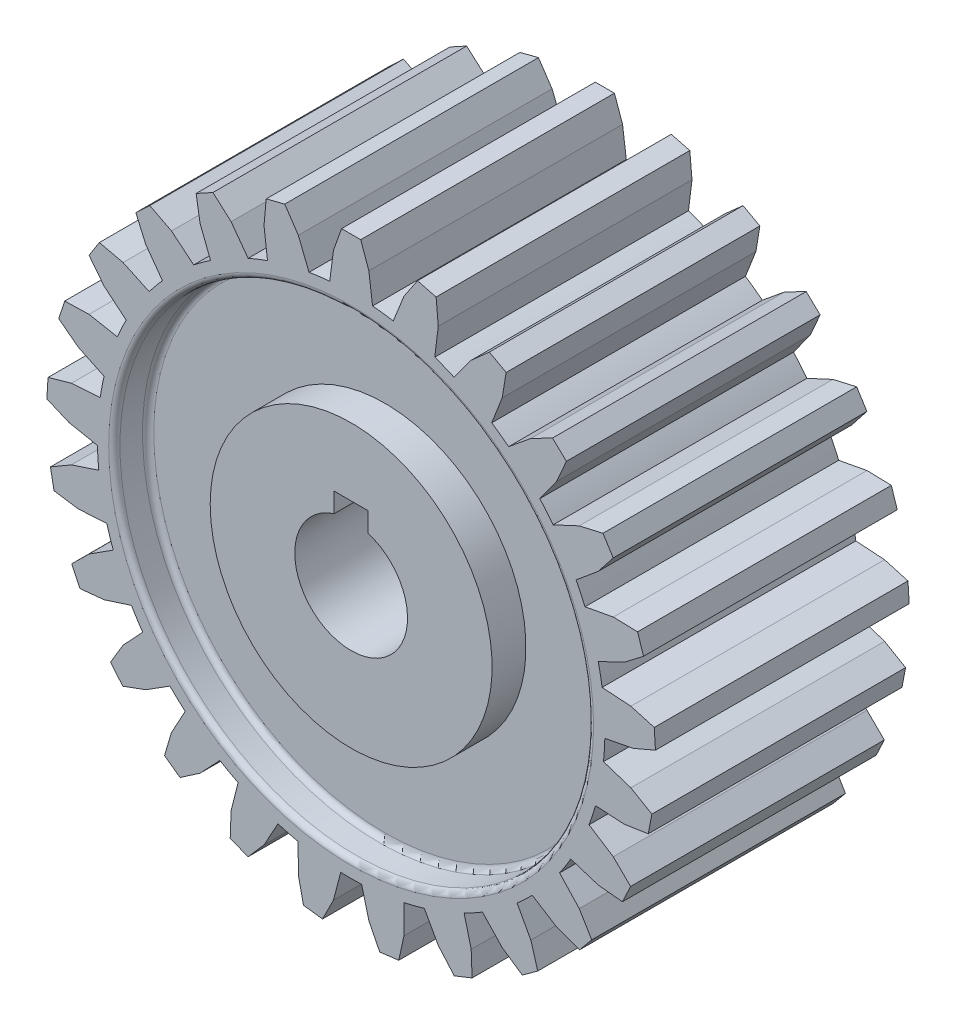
SolidWorks part; units mm, degrees
ref_plane "Front Plane" through (0, 0, 0) normal (0, 0, 1) x (1, 0, 0)
ref_plane "Top Plane" through (0, 0, 0) normal (0, 1, 0) x (1, 0, 0)
ref_plane "Right Plane" through (0, 0, 0) normal (1, 0, 0) x (0, 0, -1)
sketch "Sketch1" plane through (0, 0, 0) normal (0, 0, 1) x (1, 0, 0)
  line L0 (0, 0) -> (0, 96.9326) construction
  line L1 (-4.826, 56.9459) -> (-3.9897, 63.3745)
  line L2 (-3.9897, 63.3745) -> (-2.159, 68.546)
  line L3 (4.826, 56.9459) -> (3.9897, 63.3745)
  line L4 (3.9897, 63.3745) -> (2.159, 68.546)
  line L5 (-2.159, 68.546) -> (2.159, 68.546)
  line L6 (14.9555, 66.9294) -> (19.1379, 65.8556)
  line L7 (11.8962, 62.3757) -> (14.9555, 66.9294)
  line L8 (9.4875, 56.357) -> (11.8962, 62.3757)
  line L9 (18.8362, 53.9566) -> (19.625, 60.3913)
  line L10 (19.625, 60.3913) -> (19.1379, 65.8556)
  line L11 (31.1303, 61.1074) -> (34.9142, 59.0272)
  line L12 (27.0347, 57.4576) -> (31.1303, 61.1074)
  line L13 (23.2048, 52.227) -> (27.0347, 57.4576)
  line L14 (31.6629, 47.5771) -> (34.0271, 53.6135)
  line L15 (34.0271, 53.6135) -> (34.9142, 59.0272)
  line L16 (45.3491, 51.4458) -> (48.4968, 48.49)
  line L17 (40.4745, 48.9292) -> (45.3491, 51.4458)
  line L18 (35.4641, 44.8154) -> (40.4745, 48.9292)
  line L19 (42.5001, 38.2081) -> (46.2912, 43.4669)
  line L20 (46.2912, 43.4669) -> (48.4968, 48.49)
  line L21 (56.7185, 38.5517) -> (59.0322, 34.9059)
  line L22 (51.3711, 37.3264) -> (56.7185, 38.5517)
  line L23 (45.4951, 34.5879) -> (51.3711, 37.3264)
  line L24 (50.6669, 26.4384) -> (55.6467, 30.5892)
  line L25 (55.6467, 30.5892) -> (59.0322, 34.9059)
  line L26 (64.524, 23.2352) -> (65.8583, 19.1286)
  line L27 (59.0399, 23.3782) -> (64.524, 23.2352)
  line L28 (52.6674, 22.187) -> (59.0399, 23.3782)
  line L29 (55.6501, 13.0074) -> (61.5057, 15.7894)
  line L30 (61.5057, 15.7894) -> (65.8583, 19.1286)
  line L31 (68.2752, 6.4588) -> (68.5463, 2.1493)
  line L32 (62.999, 7.9612) -> (68.2752, 6.4588)
  line L33 (56.5305, 8.3921) -> (62.999, 7.9612)
  line L34 (57.1365, -1.2408) -> (63.5, -0.0025)
  line L35 (63.5, -0.0025) -> (68.5463, 2.1493)
  line L36 (67.7364, -10.7235) -> (66.9273, -14.965)
  line L37 (62.9996, -7.9562) -> (67.7364, -10.7235)
  line L38 (56.8415, -5.9301) -> (62.9996, -7.9562)
  line L39 (55.0329, -15.4111) -> (61.5044, -15.7942)
  line L40 (61.5044, -15.7942) -> (66.9273, -14.965)
  line L41 (62.9415, -27.2319) -> (61.103, -31.139)
  line L42 (59.0417, -23.3736) -> (62.9415, -27.2319)
  line L43 (53.581, -19.8797) -> (59.0417, -23.3736)
  line L44 (49.4714, -28.6131) -> (55.6443, -30.5936)
  line L45 (55.6443, -30.5936) -> (61.103, -31.139)
  line L46 (54.1918, -42.0293) -> (51.4394, -45.3564)
  line L47 (51.3741, -37.3223) -> (54.1918, -42.0293)
  line L48 (46.9538, -32.5802) -> (51.3741, -37.3223)
  line L49 (40.8013, -40.0172) -> (46.2878, -43.4706)
  line L50 (46.2878, -43.4706) -> (51.4394, -45.3564)
  line L51 (42.037, -54.1859) -> (38.5437, -56.7239)
  line L52 (40.4784, -48.926) -> (42.037, -54.1859)
  line L53 (37.3763, -43.2335) -> (40.4784, -48.926)
  line L54 (29.5676, -48.9068) -> (34.0229, -53.6162)
  line L55 (34.0229, -53.6162) -> (38.5437, -56.7239)
  line L56 (27.2409, -62.9377) -> (23.2261, -64.5272)
  line L57 (27.0393, -57.4554) -> (27.2409, -62.9377)
  line L58 (25.4503, -51.1704) -> (27.0393, -57.4554)
  line L59 (16.4761, -54.7235) -> (19.6202, -60.3929)
  line L60 (19.6202, -60.3929) -> (23.2261, -64.5272)
  line L61 (10.7331, -67.7349) -> (6.4491, -68.2761)
  line L62 (11.9012, -62.3748) -> (10.7331, -67.7349)
  line L63 (11.9252, -55.892) -> (11.9012, -62.3748)
  line L64 (2.3493, -57.1017) -> (3.9847, -63.3749)
  line L65 (3.9847, -63.3749) -> (6.4491, -68.2761)
  line L66 (-6.4491, -68.2761) -> (-10.7331, -67.7349)
  line L67 (-3.9847, -63.3749) -> (-6.4491, -68.2761)
  line L68 (-2.3493, -57.1017) -> (-3.9847, -63.3749)
  line L69 (-11.9252, -55.892) -> (-11.9012, -62.3748)
  line L70 (-11.9012, -62.3748) -> (-10.7331, -67.7349)
  line L71 (-23.2261, -64.5272) -> (-27.2409, -62.9377)
  line L72 (-19.6202, -60.3929) -> (-23.2261, -64.5272)
  line L73 (-16.4761, -54.7235) -> (-19.6202, -60.3929)
  line L74 (-25.4503, -51.1704) -> (-27.0393, -57.4554)
  line L75 (-27.0393, -57.4554) -> (-27.2409, -62.9377)
  line L76 (-38.5437, -56.7239) -> (-42.037, -54.1859)
  line L77 (-34.0229, -53.6162) -> (-38.5437, -56.7239)
  line L78 (-29.5676, -48.9068) -> (-34.0229, -53.6162)
  line L79 (-37.3763, -43.2335) -> (-40.4784, -48.926)
  line L80 (-40.4784, -48.926) -> (-42.037, -54.1859)
  line L81 (-51.4394, -45.3564) -> (-54.1918, -42.0293)
  line L82 (-46.2878, -43.4706) -> (-51.4394, -45.3564)
  line L83 (-40.8013, -40.0172) -> (-46.2878, -43.4706)
  line L84 (-46.9538, -32.5802) -> (-51.3741, -37.3223)
  line L85 (-51.3741, -37.3223) -> (-54.1918, -42.0293)
  line L86 (-61.103, -31.139) -> (-62.9415, -27.2319)
  line L87 (-55.6443, -30.5936) -> (-61.103, -31.139)
  line L88 (-49.4714, -28.6131) -> (-55.6443, -30.5936)
  line L89 (-53.581, -19.8797) -> (-59.0417, -23.3736)
  line L90 (-59.0417, -23.3736) -> (-62.9415, -27.2319)
  line L91 (-66.9273, -14.965) -> (-67.7364, -10.7235)
  line L92 (-61.5044, -15.7942) -> (-66.9273, -14.965)
  line L93 (-55.0329, -15.4111) -> (-61.5044, -15.7942)
  line L94 (-56.8415, -5.9301) -> (-62.9996, -7.9562)
  line L95 (-62.9996, -7.9562) -> (-67.7364, -10.7235)
  line L96 (-68.5463, 2.1493) -> (-68.2752, 6.4588)
  line L97 (-63.5, -0.0025) -> (-68.5463, 2.1493)
  line L98 (-57.1365, -1.2408) -> (-63.5, -0.0025)
  line L99 (-56.5305, 8.3921) -> (-62.999, 7.9612)
  line L100 (-62.999, 7.9612) -> (-68.2752, 6.4588)
  line L101 (-65.8583, 19.1286) -> (-64.524, 23.2352)
  line L102 (-61.5057, 15.7894) -> (-65.8583, 19.1286)
  line L103 (-55.6501, 13.0074) -> (-61.5057, 15.7894)
  line L104 (-52.6674, 22.187) -> (-59.0399, 23.3782)
  line L105 (-59.0399, 23.3782) -> (-64.524, 23.2352)
  line L106 (-59.0322, 34.9059) -> (-56.7185, 38.5517)
  line L107 (-55.6467, 30.5892) -> (-59.0322, 34.9059)
  line L108 (-50.6669, 26.4384) -> (-55.6467, 30.5892)
  line L109 (-45.4951, 34.5879) -> (-51.3711, 37.3264)
  line L110 (-51.3711, 37.3264) -> (-56.7185, 38.5517)
  line L111 (-48.4968, 48.49) -> (-45.3491, 51.4458)
  line L112 (-46.2912, 43.4669) -> (-48.4968, 48.49)
  line L113 (-42.5001, 38.2081) -> (-46.2912, 43.4669)
  line L114 (-35.4641, 44.8154) -> (-40.4745, 48.9292)
  line L115 (-40.4745, 48.9292) -> (-45.3491, 51.4458)
  line L116 (-34.9142, 59.0272) -> (-31.1303, 61.1074)
  line L117 (-34.0271, 53.6135) -> (-34.9142, 59.0272)
  line L118 (-31.6629, 47.5771) -> (-34.0271, 53.6135)
  line L119 (-23.2048, 52.227) -> (-27.0347, 57.4576)
  line L120 (-27.0347, 57.4576) -> (-31.1303, 61.1074)
  line L121 (-19.1379, 65.8556) -> (-14.9555, 66.9294)
  line L122 (-19.625, 60.3913) -> (-19.1379, 65.8556)
  line L123 (-18.8362, 53.9566) -> (-19.625, 60.3913)
  line L124 (-9.4875, 56.357) -> (-11.8962, 62.3757)
  line L125 (-11.8962, 62.3757) -> (-14.9555, 66.9294)
  circle A0 centre (0, 0) radius 63.5 construction
  circle A1 centre (0, 0) radius 68.58 construction
  arc A2 (-31.6629, 47.5771) -> (-35.4641, 44.8154) centre (0, 0) ccw
  arc A3 (-42.5001, 38.2081) -> (-45.4951, 34.5879) centre (0, 0) ccw
  arc A4 (-18.8362, 53.9566) -> (-23.2048, 52.227) centre (0, 0) ccw
  arc A5 (-4.826, 56.9459) -> (-9.4875, 56.357) centre (0, 0) ccw
  arc A6 (9.4875, 56.357) -> (4.826, 56.9459) centre (0, 0) ccw
  arc A7 (23.2048, 52.227) -> (18.8362, 53.9566) centre (0, 0) ccw
  arc A8 (35.4641, 44.8154) -> (31.6629, 47.5771) centre (0, 0) ccw
  arc A9 (45.4951, 34.5879) -> (42.5001, 38.2081) centre (0, 0) ccw
  arc A10 (52.6674, 22.187) -> (50.6669, 26.4384) centre (0, 0) ccw
  arc A11 (56.5305, 8.3921) -> (55.6501, 13.0074) centre (0, 0) ccw
  arc A12 (56.8415, -5.9301) -> (57.1365, -1.2408) centre (0, 0) ccw
  arc A13 (53.581, -19.8797) -> (55.0329, -15.4111) centre (0, 0) ccw
  arc A14 (46.9538, -32.5802) -> (49.4714, -28.6131) centre (0, 0) ccw
  arc A15 (37.3763, -43.2335) -> (40.8013, -40.0172) centre (0, 0) ccw
  arc A16 (25.4503, -51.1704) -> (29.5676, -48.9068) centre (0, 0) ccw
  arc A17 (11.9252, -55.892) -> (16.4761, -54.7235) centre (0, 0) ccw
  arc A18 (-2.3493, -57.1017) -> (2.3493, -57.1017) centre (0, 0) ccw
  arc A19 (-16.4761, -54.7235) -> (-11.9252, -55.892) centre (0, 0) ccw
  arc A20 (-29.5676, -48.9068) -> (-25.4503, -51.1704) centre (0, 0) ccw
  arc A21 (-40.8013, -40.0172) -> (-37.3763, -43.2335) centre (0, 0) ccw
  arc A22 (-49.4714, -28.6131) -> (-46.9538, -32.5802) centre (0, 0) ccw
  arc A23 (-55.0329, -15.4111) -> (-53.581, -19.8797) centre (0, 0) ccw
  arc A24 (-57.1365, -1.2408) -> (-56.8415, -5.9301) centre (0, 0) ccw
  arc A25 (-50.6669, 26.4384) -> (-52.6674, 22.187) centre (0, 0) ccw
  arc A26 (-55.6501, 13.0074) -> (-56.5305, 8.3921) centre (0, 0) ccw
  point P159 (0, 0)
  dimension "D1" = 127
  dimension "D2" = 137.16
  dimension "D3" = 114.3
  dimension "D4" = 9.652
  dimension "D5" = 7.9794
  dimension "D6" = 4.318
  dimension "D7" = 25
extrude "Boss-Extrude2" add sketch "Sketch1" along normal blind 57.15
sketch "Sketch5" plane through (0, 0, 57.15) normal (0, 0, 1) x (1, 0, 0)
  circle A0 centre (0, 0) radius 53.34
  dimension "D1" = 106.68
extrude "Cut-Extrude3" cut sketch "Sketch5" against normal blind 7.62
sketch "Sketch6" plane through (0, 0, 49.53) normal (0, 0, 1) x (1, 0, 0)
  circle A0 centre (0, 0) radius 31.75
  dimension "D1" = 63.5
extrude "Boss-Extrude4" add sketch "Sketch6" along normal blind 7.62
sketch "Sketch7" plane through (0, 0, 57.15) normal (0, 0, 1) x (1, 0, 0)
  line L0 (0, 0) -> (0, 45.664) construction
  line L2 (3.81, 16.51) -> (-3.81, 16.51)
  line L3 (3.81, 16.51) -> (3.81, 12.115)
  line L5 (-3.81, 16.51) -> (-3.81, 12.115)
  line L6 (3.81, 16.51) -> (0, 12.7) construction
  line L7 (3.81, 8.89) -> (-3.81, 16.51) construction
  arc A0 (-3.81, 12.115) -> (3.81, 12.115) centre (0, 0) ccw
  point P3 (0, 12.7)
  dimension "D1" = 25.4
  dimension "D2" = 7.62
extrude "Cut-Extrude4" cut sketch "Sketch7" against normal blind 108.458
fillet "Fillet1" radius 1.27 1 edges at (53.34, 0, 49.53)
fillet "Fillet3" radius 1.27 1 edges at (53.34, 0, 57.15)
ref_plane "Plane1" through (0, 0, 28.575) normal (0, 0, 1) x (1, 0, 0)
mirror "Mirror3" about plane through (0, 0, 28.575) normal (0, 0, 1) of "Cut-Extrude4", "Cut-Extrude3", "Boss-Extrude4"
fillet "Fillet4" radius 1.27 2 edges at (53.34, 0, 7.62) (53.34, 0, 0)
